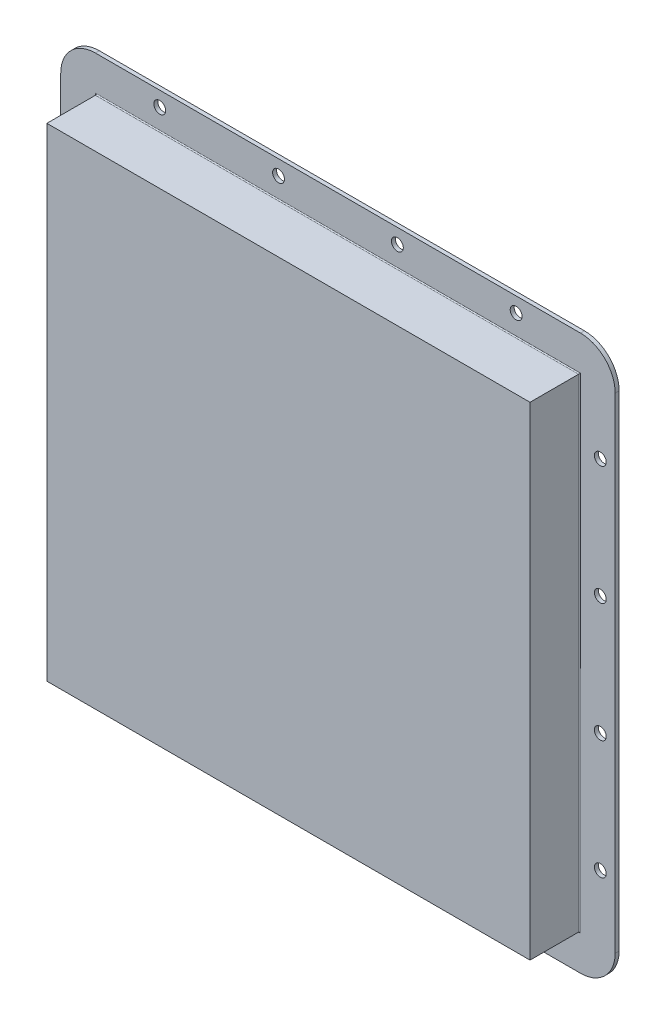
SolidWorks part; units mm, degrees
ref_plane "Front Plane" through (0, 0, 0) normal (0, 0, 1) x (1, 0, 0)
ref_plane "Top Plane" through (0, 0, 0) normal (0, 1, 0) x (1, 0, 0)
ref_plane "Right Plane" through (0, 0, 0) normal (1, 0, 0) x (0, 0, -1)
sketch "Sketch1" plane through (0, 0, 0) normal (0, 0, 1) x (1, 0, 0)
  line L1 (244, -244) -> (-244, -244)
  line L2 (244, -244) -> (244, 244)
  line L3 (244, 244) -> (-244, 244)
  line L4 (-244, -244) -> (-244, 244)
  line L5 (244, -244) -> (-244, 244) construction
  line L6 (244, 244) -> (-244, -244) construction
  point P0 (0, 0)
  dimension "D1" = 488
extrude "Boss-Extrude1" add sketch "Sketch1" along normal blind 4 contours L2 L3 L4 L1
sketch "Sketch2" plane through (0, 0, 0) normal (0, 0, -1) x (-1, 0, 0)
  line L0 (-240, 240) -> (240, 240)
  line L1 (-244, -244) -> (244, -244)
  line L2 (-244, -244) -> (-244, 244)
  line L3 (-244, 244) -> (244, 244)
  line L4 (244, -244) -> (244, 244)
  line L5 (-244, -244) -> (244, 244) construction
  line L6 (-244, 244) -> (244, -244) construction
  line L7 (240, -240) -> (240, 240)
  line L8 (-240, -240) -> (240, -240)
  line L9 (-240, -240) -> (-240, 240)
  point P0 (0, 0)
  dimension "D1" = 4
extrude "Boss-Extrude2" add sketch "Sketch2" along normal blind 50
sketch "Sketch3" plane through (0, 0, -50) normal (0, 0, -1) x (-1, 0, 0)
  line L0 (280, -280) -> (280, 280)
  line L1 (-244, -244) -> (244, -244)
  line L2 (-244, -244) -> (-244, 244)
  line L3 (-244, 244) -> (244, 244)
  line L4 (244, -244) -> (244, 244)
  line L5 (-244, -244) -> (244, 244) construction
  line L6 (-244, 244) -> (244, -244) construction
  line L7 (-280, 280) -> (280, 280)
  line L8 (-280, -280) -> (-280, 280)
  line L9 (-280, -280) -> (280, -280)
  point P0 (0, 0)
  dimension "D1" = 36
extrude "Boss-Extrude3" add sketch "Sketch3" against normal blind 4
fillet "Fillet1" radius 5 4 edges at (0, -240, -50) (-240, 0, -50) (240, 0, -50) (0, 240, -50)
fillet "Fillet2" radius 1 4 edges at (0, 244, -46) (-244, 0, -46) (244, 0, -46) (0, -244, -46)
fillet "Fillet3" radius 35 4 edges at (-280, 280, -48) (280, 280, -48) (-280, -280, -48) (280, -280, -48)
sketch "Sketch4" plane through (0, 0, -50) normal (0, 0, -1) x (-1, 0, 0)
  line L0 (280, -245) -> (280, 245) construction
  line L1 (-265, 265) -> (265, 265) construction
  line L2 (-265, 265) -> (-265, -265) construction
  line L3 (-265, -265) -> (265, -265) construction
  line L4 (265, 265) -> (265, -265) construction
  line L5 (-265, 265) -> (265, -265) construction
  line L6 (-265, -265) -> (265, 265) construction
  line L7 (-245, -280) -> (245, -280) construction
  circle A0 centre (180, 265) radius 6
  circle A1 centre (265, 180) radius 6
  circle A2 centre (265, 60) radius 6
  circle A3 centre (265, -60) radius 6
  circle A4 centre (265, -180) radius 6
  circle A5 centre (60, 265) radius 6
  circle A6 centre (-60, 265) radius 6
  circle A7 centre (-180, 265) radius 6
  circle A8 centre (-180, -265) radius 6
  circle A9 centre (-265, -180) radius 6
  circle A10 centre (-265, -60) radius 6
  circle A11 centre (-265, 60) radius 6
  circle A12 centre (-265, 180) radius 6
  circle A13 centre (-60, -265) radius 6
  circle A14 centre (60, -265) radius 6
  circle A15 centre (180, -265) radius 6
  point P0 (0, 0)
  point P14 (0, 0)
  point P24 (0, 0)
  point P28 (70.229, -265)
  point P45 (0, 0)
  point P46 (0, 0)
  point P47 (0, 0)
  point P48 (0, 0)
  dimension "D3" = 12
  dimension "D5" = 180
  dimension "D9" = 120
  dimension "D1" = 15
  dimension "D2" = 15
  dimension "D4" = 180
  dimension "D7" = 120
  dimension "D6" = 4
  dimension "D8" = 4
  dimension "D10" = 2
extrude "Cut-Extrude2" cut sketch "Sketch4" against normal blind 4
ref_plane "Plane1" through (0, -120, 0) normal (0, 1, 0) x (1, 0, 0)
sketch "Sketch5" plane through (0, -120, 0) normal (0, 1, 0) x (1, 0, 0)
  line L0 (-75, 0) -> (-75, 55)
  line L1 (-60, 70) -> (60, 70)
  line L2 (75, 55) -> (75, 0)
  line L3 (0, 0) -> (0, 70) construction
  line L4 (-240, 0) -> (240, 0) construction
  arc A0 (60, 70) -> (75, 55) centre (60, 55) cw
  arc A1 (-75, 55) -> (-60, 70) centre (-60, 55) cw
  point P7 (-75, 6.4646)
  point P8 (0, 80.1466)
  point P9 (0, 0)
  point P14 (75, 70)
  point P17 (-75, 70)
  dimension "D3" = 15
  dimension "D1" = 150
  dimension "D2" = 70
sketch "Sketch6" plane through (0, 0, 0) normal (0, 0, -1) x (-1, 0, 0)
  circle A0 centre (-75, -120) radius 5
  dimension "D1" = 10
sweep "Sweep1" add profiles "Sketch6" path "Sketch5"
mirror "Mirror1" about plane through (0, 0, 0) normal (0, 1, 0) of "Sweep1"
